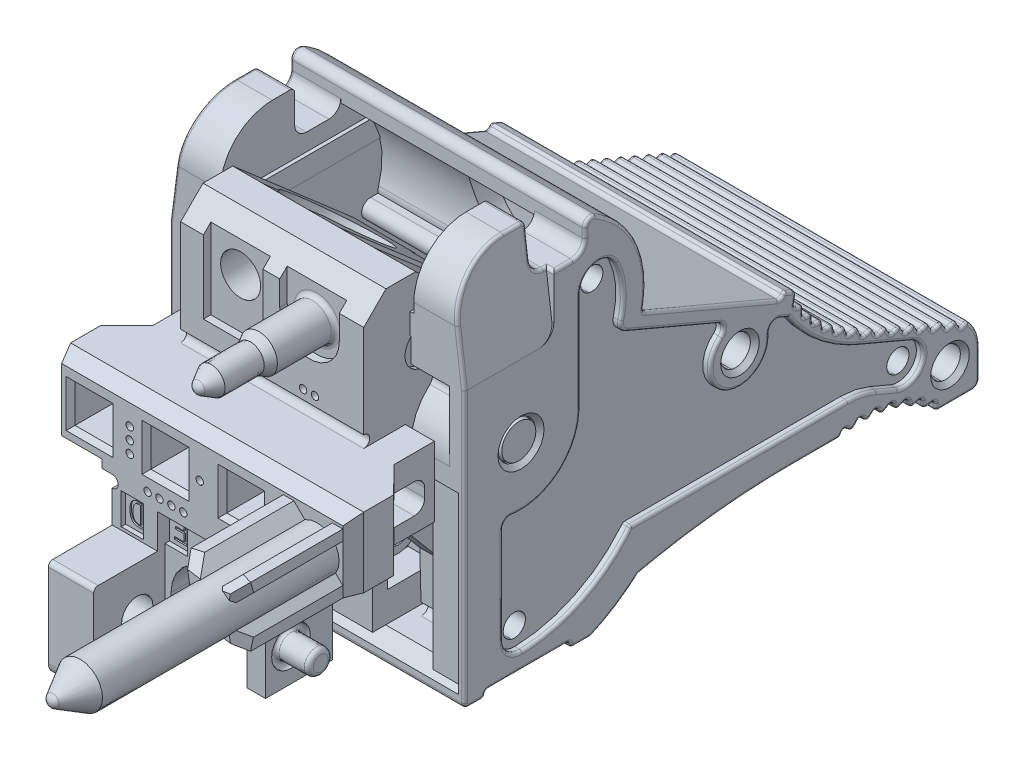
SolidWorks part; units mm, degrees
ref_plane "前视基准面" through (0, 0, 0) normal (0, 0, 1) x (1, 0, 0)
ref_plane "上视基准面" through (0, 0, 0) normal (0, 1, 0) x (1, 0, 0)
ref_plane "右视基准面" through (0, 0, 0) normal (1, 0, 0) x (0, 0, -1)
imported_body "输入1"
imported_body "输入3"
imported_body "输入4"
imported_body "输入8"
sketch "草图1" plane through (0, 0, -22.5744) normal (0, 0, 1) x (1, 0, 0)
  line L0 (-2.644, 99.8262) -> (-1.138, 99.8262) construction
  line L1 (-2.644, 98.0162) -> (-2.644, 100.1246) construction
  line L2 (-1.138, 98.0162) -> (-1.138, 100.1246) construction
  line L3 (-1.138, 98.0162) -> (-2.644, 98.0162) construction
  line L5 (-5.656, 99.8262) -> (-7.162, 99.8262) construction
  line L6 (-5.656, 100.1246) -> (-5.656, 98.0162) construction
  line L7 (-7.162, 100.1246) -> (-7.162, 98.0162) construction
  text T0 "F" font "黑体" height 1.5
  text T1 "E" font "黑体" height 1.5
  dimension "D1" = 1.81
extrude "切除-拉伸1" cut sketch "草图1" against normal blind 0.1
sketch "草图2" plane through (0, 0, -22.0724) normal (0, 0, 1) x (1, 0, 0)
  line L0 (-9.6218, 99.8246) -> (-8.1158, 99.8246) construction
  line L1 (-9.6218, 98.0162) -> (-9.6218, 100.1246) construction
  line L2 (-8.1158, 100.1246) -> (-8.1158, 98.0162) construction
  line L3 (-9.6218, 100.1246) -> (-8.1158, 100.1246) construction
  text T0 "D" font "黑体" height 1.5
  dimension "D1" = 0.3
extrude "切除-拉伸2" cut sketch "草图2" against normal blind 0.1
